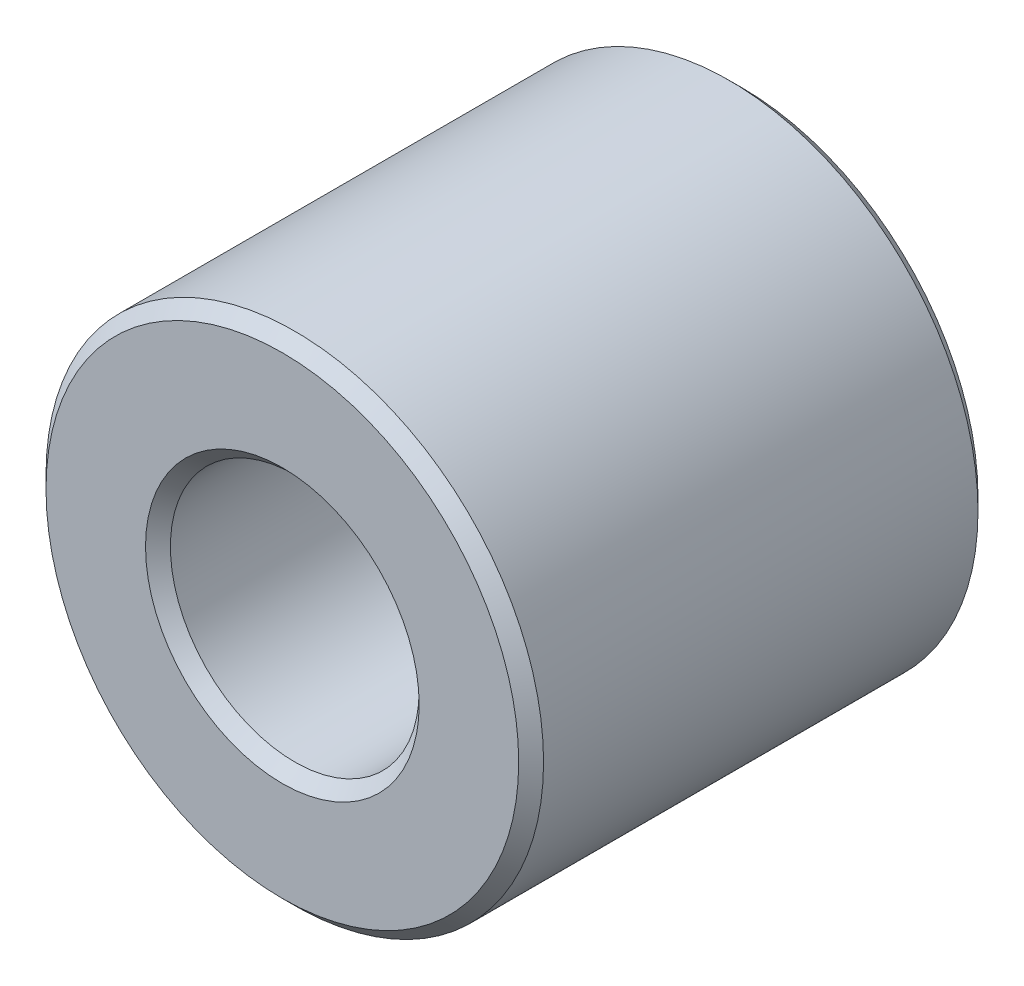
SolidWorks part; units mm, degrees
ref_plane "Front Plane" through (0, 0, 0) normal (0, 0, 1) x (1, 0, 0)
ref_plane "Top Plane" through (0, 0, 0) normal (0, 1, 0) x (1, 0, 0)
ref_plane "Right Plane" through (0, 0, 0) normal (1, 0, 0) x (0, 0, -1)
sketch "Sketch1" plane through (0, 0, 0) normal (0, 0, 1) x (1, 0, 0)
  circle A0 centre (0, 0) radius 6.5
  circle A1 centre (0, 0) radius 13
  dimension "D1" = 13
  dimension "D2" = 26
extrude "Boss-Extrude1" add sketch "Sketch1" along normal mid plane 24
chamfer "Chamfer1" distance 0.65 angle 45 4 edges at (6.5, 0, -12) (13, 0, -12) (6.5, 0, 12) (13, 0, 12)
